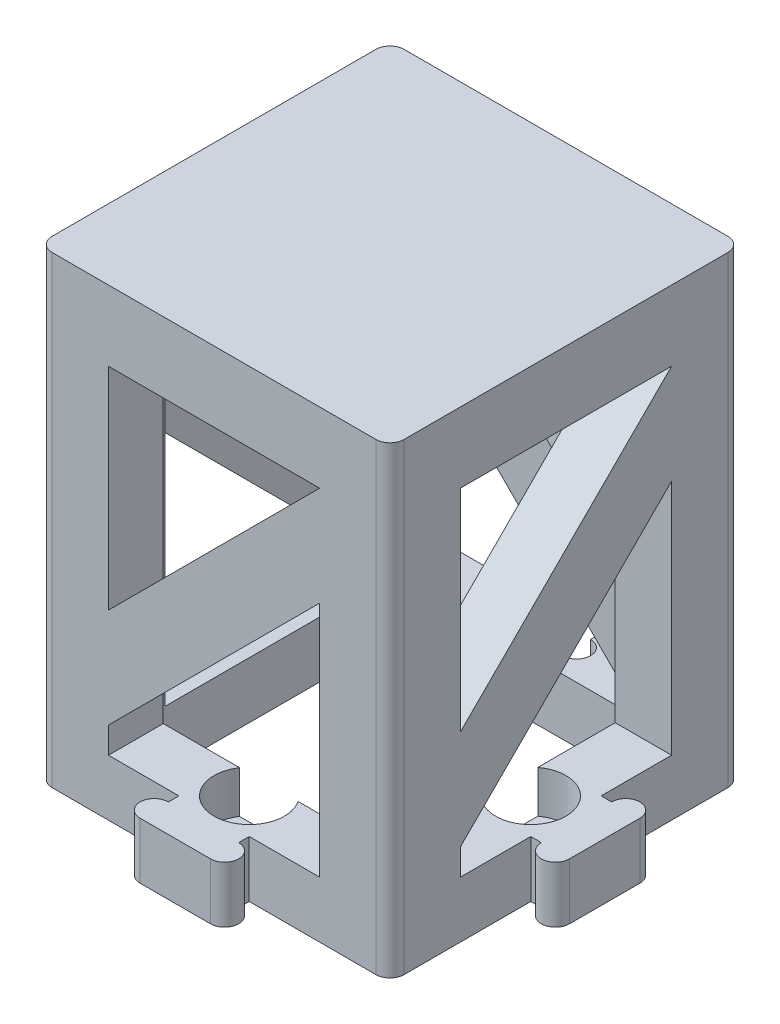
SolidWorks part; units mm, degrees
ref_plane "Front Plane" through (0, 0, 0) normal (0, 0, 1) x (1, 0, 0)
ref_plane "Top Plane" through (0, 0, 0) normal (0, 1, 0) x (1, 0, 0)
ref_plane "Right Plane" through (0, 0, 0) normal (1, 0, 0) x (0, 0, -1)
sketch "Sketch2" plane through (0, 0, 0) normal (0, 1, 0) x (1, 0, 0)
  line L0 (0, -25) -> (0, -20) construction
  line L1 (23, -25) -> (-23, -25)
  line L2 (25, -23) -> (25, 23)
  line L3 (23, 25) -> (5, 25)
  line L4 (-25, -23) -> (-25, -5)
  line L5 (25, -25) -> (-25, 25) construction
  line L6 (25, 25) -> (-25, -25) construction
  line L7 (15, -17.2179) -> (1.25, -17.2179)
  line L8 (17, -15.2179) -> (17, -1.25)
  line L9 (15, 17.2179) -> (-15, 17.2179)
  line L10 (-17, -15.2179) -> (-17, 15.2179)
  line L11 (17, -17.2179) -> (-17, 17.2179) construction
  line L12 (17, 17.2179) -> (-17, -17.2179) construction
  line L13 (25, 0) -> (20, 0) construction
  line L14 (25, 5) -> (26.5, 5)
  line L15 (25, 0) -> (33.3042, 0) construction
  line L16 (25, -5) -> (26.5, -5)
  line L17 (30.5, 5) -> (30.5, -5)
  line L18 (5, -30.5) -> (-5, -30.5)
  line L19 (-5, -25) -> (-5, -26.5)
  line L20 (0, 0) -> (25, -5) construction
  line L21 (0, 0) -> (-5, -25) construction
  line L22 (5, -26.5) -> (5, -25)
  line L23 (0, 25) -> (0, 17.2179) construction
  line L24 (-5, 25) -> (-5, 23.5)
  line L25 (5, 25) -> (5, 23.5)
  line L26 (-5, 19.5) -> (5, 19.5)
  line L27 (-5, 25) -> (-23, 25)
  line L28 (-19.5, -5) -> (-19.5, 5)
  line L29 (-25, 5) -> (-23.5, 5)
  line L30 (-25, -5) -> (-23.5, -5)
  line L31 (-25, 5) -> (-25, 23)
  line L32 (17, 1.25) -> (17, 15.2179)
  line L33 (-1.25, -17.2179) -> (-15, -17.2179)
  arc A0 (23, -25) -> (25, -23) centre (23, -23) ccw
  arc A1 (25, 23) -> (23, 25) centre (23, 23) ccw
  arc A2 (17, 15.2179) -> (15, 17.2179) centre (15, 15.2179) ccw
  arc A3 (15, -17.2179) -> (17, -15.2179) centre (15, -15.2179) ccw
  arc A4 (-15, -17.2179) -> (-17, -15.2179) centre (-15, -15.2179) cw
  arc A5 (-23, -25) -> (-25, -23) centre (-23, -23) cw
  arc A6 (-15, 17.2179) -> (-17, 15.2179) centre (-15, 15.2179) ccw
  arc A7 (-23, 25) -> (-25, 23) centre (-23, 23) ccw
  arc A8 (-1.25, -17.2179) -> (1.25, -17.2179) centre (0, -20) ccw
  arc A9 (17, -1.25) -> (17, 1.25) centre (20, 0) ccw
  arc A10 (26.5, 5) -> (30.5, 5) centre (28.5, 5) cw
  arc A11 (26.5, -5) -> (30.5, -5) centre (28.5, -5) ccw
  arc A12 (-5, -26.5) -> (-5, -30.5) centre (-5, -28.5) ccw
  arc A13 (5, -26.5) -> (5, -30.5) centre (5, -28.5) cw
  arc A14 (-5, 23.5) -> (-5, 19.5) centre (-5, 21.5) ccw
  arc A15 (5, 23.5) -> (5, 19.5) centre (5, 21.5) cw
  arc A16 (-23.5, -5) -> (-19.5, -5) centre (-21.5, -5) ccw
  arc A17 (-23.5, 5) -> (-19.5, 5) centre (-21.5, 5) cw
  circle A18 centre (-20, -20) radius 2.55
  circle A19 centre (-20, 20) radius 2.55
  circle A20 centre (20, 20) radius 2.55
  circle A21 centre (20, -20) radius 2.55
  point P0 (0, 0)
  point P6 (0, 0)
  point P82 (0, 0)
  point P91 (0, 0)
  dimension "D4" = 2
  dimension "D8" = 2
  dimension "D9" = 5.5
  dimension "D14" = 2
  dimension "D20" = 2
  dimension "D25" = 2
  dimension "D26" = 5.1
  dimension "D27" = 5.1
  dimension "D33" = 6.1
  dimension "D34" = 6.5
  dimension "D1" = 50
  dimension "D2" = 50
  dimension "D3" = 34
  dimension "D5" = 5
  dimension "D6" = 5
  dimension "D7" = 10
  dimension "D10" = 2
  dimension "D11" = 90
  dimension "D12" = 1.5
  dimension "D13" = 10
  dimension "D15" = 10
  dimension "D16" = 5
  dimension "D17" = 5
  dimension "D18" = 10
  dimension "D19" = 1.5
  dimension "D22" = 1.5
  dimension "D23" = 20
  dimension "D24" = 10
  dimension "D28" = 5
  dimension "D29" = 4
  dimension "D30" = 5
  dimension "D31" = 5
  dimension "D32" = 5
  dimension "D35" = 13.75
  dimension "D21" = 2
extrude "Boss-Extrude2" add sketch "Sketch2" along normal blind 8 contours L29 A17 L28 A16 L30 L4 A5 L1 A0 L2 A1 L3 L25 A15 L26 A14 L24 L27 A7 L31 A21 A20 A19 A18 A9 L8 A3 L7 A8 L33 A4 L10 A6 L9 A2 L32 | A13 L22 L1 L19 A12 L18 | L16 A11 L17 A10 L14 L2
sketch "Sketch3" plane through (0, 8, 0) normal (0, 1, 0) x (1, 0, 0)
  circle A0 centre (0, -20) radius 5
  circle A1 centre (20, 0) radius 5
  dimension "D1" = 10
extrude "Cut-Extrude1" cut sketch "Sketch3" against normal blind 6
sketch "Sketch5" plane through (0, 0, 0) normal (0, -1, 0) x (1, 0, 0)
  circle A0 centre (-20, 20) radius 3
  circle A1 centre (20, 20) radius 3
  circle A2 centre (20, -20) radius 3
  circle A3 centre (-20, -20) radius 3
  dimension "D1" = 6
extrude "Boss-Extrude3" add sketch "Sketch5" against normal blind 4.5
sketch "Sketch6" plane through (0, 8, 0) normal (0, 1, 0) x (1, 0, 0)
  line L0 (-5, -25) -> (-23, -25) construction
  line L1 (-17, -15) -> (-25, -15)
  line L2 (-15, -17.2179) -> (-15, -25)
  line L3 (-15, -25) -> (-23, -25)
  line L4 (-25, -15) -> (-25, -23)
  line L5 (-16.519, -16.519) -> (-24.4142, -24.4142) construction
  line L6 (-15, -25) -> (-25, -15) construction
  line L7 (-25, -23) -> (-25, -5) construction
  line L8 (-4.1545, -17.2179) -> (-15, -17.2179) construction
  line L9 (-17, -15.2179) -> (-17, 15.2179) construction
  line L10 (-4.1545, -17.2179) -> (-15, -17.2179)
  line L11 (-17, -15.2179) -> (-17, -15)
  line L12 (-15.2179, 17) -> (-15, 17)
  line L13 (-15, 17) -> (-15, 25)
  line L14 (-15, 25) -> (-23, 25)
  line L15 (-25, 15) -> (-25, 23)
  line L16 (-17.2179, 15) -> (-25, 15)
  line L17 (17, 15.2179) -> (17, 15)
  line L18 (17, 15) -> (25, 15)
  line L19 (25, 15) -> (25, 23)
  line L20 (15, 25) -> (23, 25)
  line L21 (15, 17.2179) -> (15, 25)
  line L22 (15.2179, -17) -> (15, -17)
  line L23 (15, -17) -> (15, -25)
  line L24 (15, -25) -> (23, -25)
  line L25 (25, -15) -> (25, -23)
  line L26 (17.2179, -15) -> (25, -15)
  arc A0 (-25, -23) -> (-23, -25) centre (-23, -23) ccw construction
  arc A1 (-17, -15.2179) -> (-15, -17.2179) centre (-15, -15.2179) ccw construction
  arc A2 (-25, -23) -> (-23, -25) centre (-23, -23) ccw
  arc A3 (-17, -15.2179) -> (-15, -17.2179) centre (-15, -15.2179) ccw
  circle A4 centre (0, 0) radius 9.4075 construction
  arc A5 (-15.2179, 17) -> (-17.2179, 15) centre (-15.2179, 15) ccw
  arc A6 (-23, 25) -> (-25, 23) centre (-23, 23) ccw
  arc A7 (17, 15.2179) -> (15, 17.2179) centre (15, 15.2179) ccw
  arc A8 (25, 23) -> (23, 25) centre (23, 23) ccw
  arc A9 (15.2179, -17) -> (17.2179, -15) centre (15.2179, -15) ccw
  arc A10 (23, -25) -> (25, -23) centre (23, -23) ccw
  point P0 (-20, -20)
  point P52 (0, 0)
  dimension "D1" = 4
extrude "Boss-Extrude4" add sketch "Sketch6" along normal blind 102 contours L2 L1 M11 M12 M30 M31 M32 M24 | A9 L23 L26 M19 M38 M39 M40 M21 | L21 L18 M15 M16 M46 M47 M48 M22 | A5 L13 L16 M13 M54 M55 M56 M23
sketch "Sketch7" plane through (0, 8, 0) normal (0, 1, 0) x (1, 0, 0)
  circle A0 centre (-20, 20) radius 2.55
  circle A1 centre (-20, -20) radius 2.55
  circle A2 centre (20, -20) radius 2.55
  circle A3 centre (20, 20) radius 2.55
extrude "Boss-Extrude5" add sketch "Sketch7" along normal blind 98.5
sketch "Sketch8" plane through (25, 0, 0) normal (1, 0, 0) x (0, 0, -1)
  line L0 (-15, 8) -> (-15, 59) construction
  line L1 (-15, 110) -> (-15, 8) construction
  line L2 (-15, 11.7157) -> (15, 41.7157)
  line L3 (15, 110) -> (15, 8) construction
  line L4 (15, 41.7157) -> (15, 55.8579)
  line L5 (15, 70) -> (-15, 100)
  line L6 (-15, 25.8579) -> (15, 55.8579)
  line L7 (-15, 11.7157) -> (-15, 25.8579)
  line L8 (15, 55.8579) -> (-15, 85.8579)
  line L10 (-15, 100) -> (-15, 85.8579)
  line L11 (15, 70) -> (15, 55.8579)
  dimension "D1" = 10
  dimension "D2" = 10
  dimension "D3" = 135
  dimension "D4" = 45
  dimension "D5" = 10
extrude "Boss-Extrude8" add sketch "Sketch8" against normal up to vertex (10 mm away) contours L11 L5 L4 L8 | L6 L4 L2
sketch "Sketch12" plane through (0, 0, -25) normal (0, 0, -1) x (-1, 0, 0)
  line L0 (-15, 8) -> (-15, 59) construction
  line L1 (-15, 11.7157) -> (15, 41.7157)
  line L2 (15, 41.7157) -> (15, 55.8579)
  line L3 (15, 70) -> (-15, 100)
  line L4 (-15, 25.8579) -> (15, 55.8579)
  line L5 (-15, 11.7157) -> (-15, 25.8579)
  line L6 (15, 55.8579) -> (-15, 85.8579)
  line L7 (-15, 100) -> (-15, 85.8579)
  line L8 (15, 70) -> (15, 55.8579)
  line L9 (15, 110) -> (15, 8) construction
  line L10 (-15, 110) -> (-15, 8) construction
  dimension "D1" = 10
  dimension "D2" = 135
  dimension "D3" = 10
  dimension "D4" = 10
  dimension "D5" = 45
extrude "Boss-Extrude9" add sketch "Sketch12" against normal up to vertex (7.7821 mm away) contours L4 L1 L2 M12 | L6 L7 L3 L8
sketch "Sketch13" plane through (-25, 0, 0) normal (-1, 0, 0) x (0, 0, 1)
  line L0 (-15, 8) -> (-15, 59) construction
  line L1 (-15, 11.7157) -> (15, 41.7157)
  line L2 (15, 41.7157) -> (15, 55.8579)
  line L3 (15, 70) -> (-15, 100)
  line L4 (-15, 25.8579) -> (15, 55.8579)
  line L5 (-15, 11.7157) -> (-15, 25.8579)
  line L6 (15, 55.8579) -> (-15, 85.8579)
  line L7 (-15, 100) -> (-15, 85.8579)
  line L8 (15, 70) -> (15, 55.8579)
  line L10 (-15, 110) -> (-15, 8) construction
  line L11 (15, 110) -> (15, 8) construction
  dimension "D1" = 10
  dimension "D2" = 135
  dimension "D3" = 10
  dimension "D4" = 45
  dimension "D5" = 10
extrude "Boss-Extrude10" add sketch "Sketch13" against normal up to vertex (7.7821 mm away) contours L8 L3 L6 M12 | L4 L1 L2 M12
sketch "Sketch14" plane through (0, 0, 25) normal (0, 0, 1) x (1, 0, 0)
  line L0 (-15, 14.3144) -> (-15, 65.3144) construction
  line L1 (-15, 11.7157) -> (15, 41.7157)
  line L2 (15, 41.7157) -> (15, 55.8579)
  line L3 (15, 70) -> (-15, 100)
  line L4 (-15, 25.8579) -> (15, 55.8579)
  line L5 (-15, 11.7157) -> (-15, 25.8579)
  line L6 (15, 55.8579) -> (-15, 85.8579)
  line L7 (-15, 100) -> (-15, 85.8579)
  line L8 (15, 70) -> (15, 55.8579)
  line L9 (-15, 110) -> (-15, 8) construction
  line L10 (15, 110) -> (15, 8) construction
  dimension "D1" = 10
  dimension "D2" = 135
  dimension "D3" = 10
  dimension "D4" = 45
  dimension "D5" = 10
extrude "Boss-Extrude11" add sketch "Sketch14" against normal up to vertex (7.7821 mm away) contours L8 L3 L6 M12 | L4 L5 L1 L2 M12
sketch "Sketch15" plane through (0, 110, 0) normal (0, 1, 0) x (1, 0, 0)
  line L0 (-25, 23) -> (-25, -23)
  line L1 (-23, -25) -> (23, -25)
  line L2 (25, -23) -> (25, 23)
  line L3 (23, 25) -> (-23, 25)
  arc A0 (-23, 25) -> (-25, 23) centre (-23, 23) ccw construction
  arc A1 (25, 23) -> (23, 25) centre (23, 23) ccw construction
  arc A2 (23, -25) -> (25, -23) centre (23, -23) ccw construction
  arc A3 (-25, -23) -> (-23, -25) centre (-23, -23) ccw construction
  arc A4 (-23, 25) -> (-25, 23) centre (-23, 23) ccw
  arc A5 (25, 23) -> (23, 25) centre (23, 23) ccw
  arc A6 (23, -25) -> (25, -23) centre (23, -23) ccw
  arc A7 (-25, -23) -> (-23, -25) centre (-23, -23) ccw
extrude "Boss-Extrude12" add sketch "Sketch15" against normal up to vertex (54.1421 mm away)
sketch "Sketch16" plane through (0, 0, 25) normal (0, 0, 1) x (1, 0, 0)
  line L0 (25, 110) -> (25, 0) construction
  line L1 (-25, 110) -> (25, 110)
  line L2 (-25, 110) -> (-25, 65.8579)
  line L3 (-25, 65.8579) -> (25, 65.8579)
  line L4 (25, 110) -> (25, 65.8579)
  line L5 (-15, 55.8579) -> (15, 55.8579) construction
  dimension "D1" = 10
extrude "Cut-Extrude2" cut sketch "Sketch16" against normal through all
